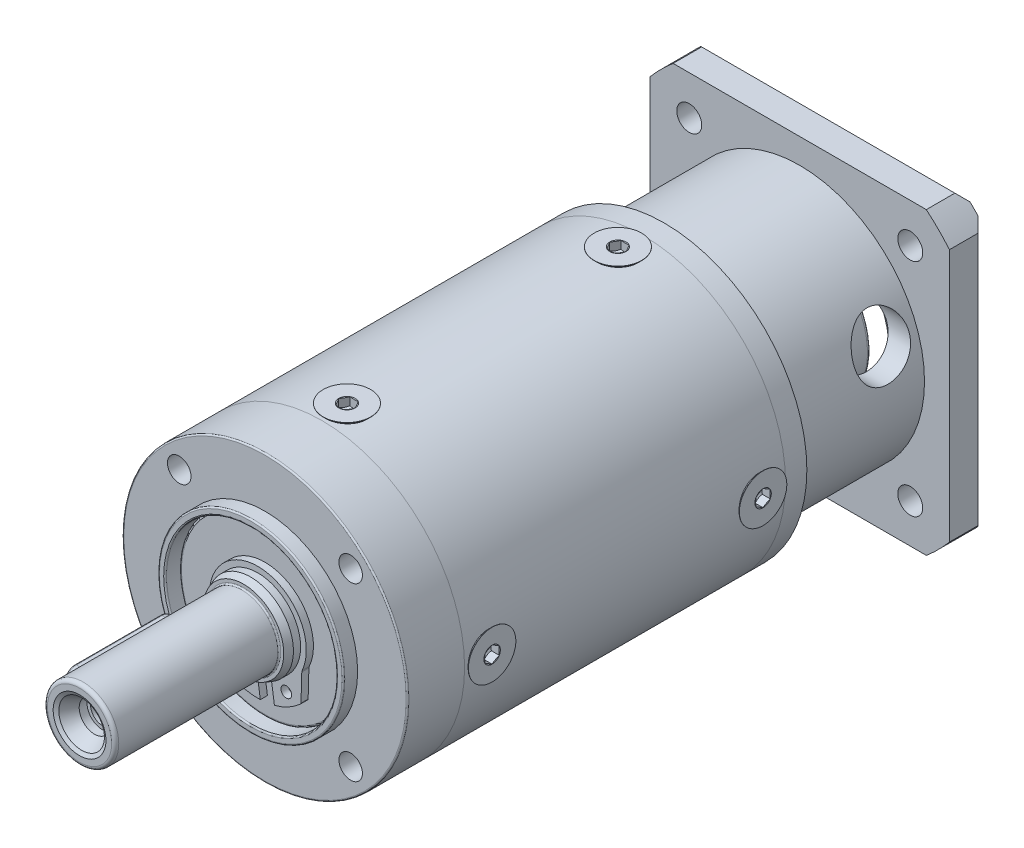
SolidWorks part; units mm, degrees
other "³ÁÍ·ÂÝ¶¤M3¡Á6-1-solid1"
other "³ÁÍ·ÂÝ¶¤M3¡Á6-7-solid1"
other "12.9-ÄÚÁù½ÇÔ²ÖùÍ·ÂÝ¶¤-M4-3-solid1"
other "Éî¹µÇòÖá³Ð60000ÐÍ18ÏµÁÐ-3-solid3"
other "Éî¹µÇòÖá³Ð60000ÐÍ18ÏµÁÐ-3-solid4"
other "Éî¹µÇòÖá³Ð60000ÐÍ18ÏµÁÐ-3-solid1"
other "ÇÐ³ý-À Éì1[1]"
other "ÖáÓÃµ¯ÐÔµ²È¦AÐÍ£¨¡Ý10£©-1-solid1"
other "¿×ÓÃµ¯ÐÔµ²È¦AÐÍ-1-solid1"
other "µ¯µæ-3-solid1"
other "ÇÐ³ý-À Éì1[2]"
other "PL40.070.5-25-22-¿Ú31-%c3.5£¨61802Öá³Ð£©-1-solid1"
other "³ÁÍ·ÂÝ¶¤M3¡Á6-5-solid1"
other "³ÁÍ·ÂÝ¶¤M3¡Á6-4-solid1"
other "Éî¹µÇòÖá³Ð60000ÐÍ18ÏµÁÐ-3-solid2"
other "Éî¹µÇòÖá³Ð60000ÐÍ19ÏµÁÐ-1-solid1"
other "³ÁÍ·ÂÝ¶¤M3¡Á6-2-solid1"
other "Éî¹µÇòÖá³Ð60000ÐÍ19ÏµÁÐ-2-solid1"
other "¿×ÓÃµ¯ÐÔµ²È¦AÐÍ-2-solid1"
other "ÆÕÍ¨Æ½¼üAÐÍ A3-1-solid1"
other "³ÁÍ·ÂÝ¶¤M3¡Á6-3-solid1"
other "PL40.090-1-solid1"
other "³ÁÍ·ÂÝ¶¤M3¡Á6-8-solid1"
other "Éî¹µÇòÖá³Ð60000ÐÍ18ÏµÁÐ-3-solid5"
other "PL40.040.05-05-1-solid1"
other "³ÁÍ·ÂÝ¶¤M3¡Á6-6-solid1"
other "OÐÍÏð½ºÃÜ·âÈ¦-2-solid1"
other "ÇÐ³ý-À Éì1[3]"
ref_plane "Front Plane" through (0, 0, 0) normal (0, 0, 1) x (1, 0, 0)
ref_plane "Top Plane" through (0, 0, 0) normal (0, 1, 0) x (1, 0, 0)
ref_plane "Right Plane" through (0, 0, 0) normal (1, 0, 0) x (0, 0, -1)
imported_body "Imported1"
imported_body "Imported2"
imported_body "Imported3"
imported_body "Imported4"
imported_body "Imported5"
imported_body "Imported6"
imported_body "Imported7"
imported_body "Imported8"
imported_body "Imported9"
imported_body "Imported10"
imported_body "Imported11"
imported_body "Imported12"
imported_body "Imported13"
imported_body "Imported14"
imported_body "Imported15"
imported_body "Imported16"
imported_body "Imported17"
imported_body "Imported18"
imported_body "Imported19"
imported_body "Imported20"
imported_body "Imported21"
imported_body "Imported22"
imported_body "Imported23"
imported_body "Imported24"
imported_body "Imported25"
imported_body "Imported26"
imported_body "Imported27"
imported_body "Imported28"
sketch "Sketch1" plane through (0, 0, 46.25) normal (0, 0, 1) x (1, 0, 0)
  circle A0 centre (-4.8099, 13.8621) radius 7.75
  circle A1 centre (-4.8099, 13.8621) radius 10.3
  circle A2 centre (-4.8099, 13.8621) radius 10.3 construction
  circle A3 centre (-4.8099, 13.8621) radius 7.75 construction
extrude "Boss-Extrude1" add sketch "Sketch1" against normal blind 0.25
ref_plane "Plane1" through (-4.8099, 0, 0) normal (1, 0, 0) x (0, 0, -1)
ref_plane "Plane2" through (0, 13.8621, 0) normal (0, 1, 0) x (0, 0, 1)
